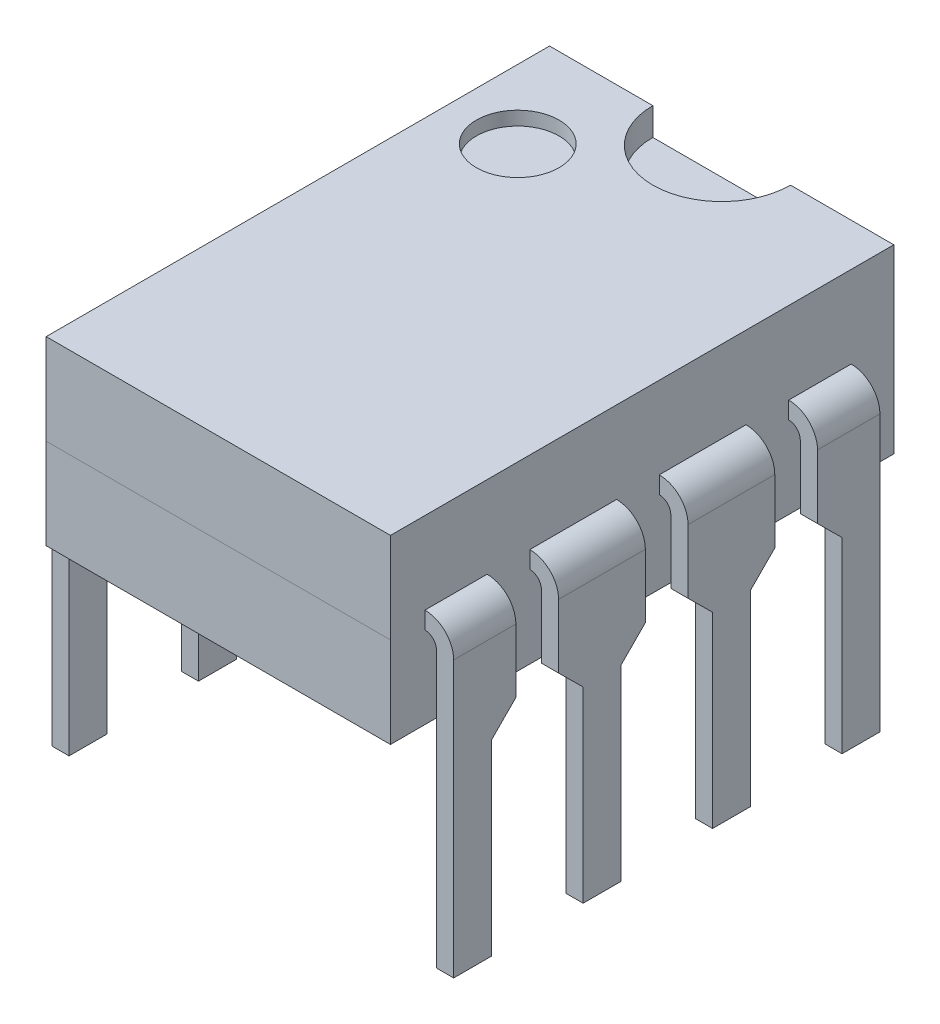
SolidWorks part; units mm, degrees
ref_plane "Front Plane" through (0, 0, 0) normal (0, 0, 1) x (1, 0, 0)
ref_plane "Top Plane" through (0, 0, 0) normal (0, 1, 0) x (1, 0, 0)
ref_plane "Right Plane" through (0, 0, 0) normal (1, 0, 0) x (0, 0, -1)
sketch "Sketch1" plane through (0, 0, 0) normal (0, 1, 0) x (1, 0, 0)
  line L1 (-3.175, 4.6419) -> (3.175, 4.6419)
  line L2 (-3.175, 4.6419) -> (-3.175, -4.6418)
  line L3 (-3.175, -4.6418) -> (3.175, -4.6418)
  line L4 (3.175, 4.6419) -> (3.175, -4.6418)
  dimension "D1" = 6.35
  dimension "D2" = 9.2837
  dimension "D3" = 3.175
  dimension "D4" = 4.6418
extrude "Boss-Extrude1" add sketch "Sketch1" along normal mid plane 3.3401
sketch "Sketch2" plane through (0, 0, 0) normal (0, 1, 0) x (1, 0, 0)
  line L0 (3.175, -2.8595) -> (4.932, -2.8595)
  line L1 (3.175, -4.6418) -> (3.175, 4.6419) construction
  line L2 (4.932, -2.8595) -> (5.3848, -3.3084)
  line L3 (5.3848, -3.3084) -> (8.8392, -3.3084)
  line L4 (8.8392, -3.3084) -> (8.8392, -4.0069)
  line L5 (8.8392, -4.0069) -> (5.3848, -4.0069)
  line L6 (3.175, -4.0069) -> (3.175, -2.8595)
  line L7 (3.175, -2.0721) -> (3.175, -0.4719)
  line L8 (3.175, -0.4719) -> (4.932, -0.4719)
  line L9 (4.932, -0.4719) -> (5.3848, -0.9208)
  line L10 (5.3848, -0.9208) -> (8.8392, -0.9208)
  line L11 (8.8392, -0.9208) -> (8.8392, -1.6193)
  line L12 (8.8392, -1.6193) -> (5.3848, -1.6193)
  line L13 (5.3848, -1.6193) -> (4.9359, -2.0721)
  line L14 (4.9359, -2.0721) -> (3.175, -2.0721)
  line L15 (3.175, 1.9157) -> (4.932, 1.9157)
  line L16 (4.932, 1.9157) -> (5.3848, 1.4668)
  line L17 (5.3848, 1.4668) -> (8.8392, 1.4668)
  line L18 (8.8392, 1.4668) -> (8.8392, 0.7684)
  line L19 (8.8392, 0.7684) -> (5.3848, 0.7684)
  line L20 (5.3848, 0.7684) -> (4.9359, 0.3155)
  line L21 (4.9359, 0.3155) -> (3.175, 0.3155)
  line L22 (3.175, 0.3155) -> (3.175, 1.9157)
  line L23 (3.175, 2.7031) -> (3.175, 3.8544)
  line L24 (5.3848, 3.8544) -> (8.8392, 3.8544)
  line L25 (8.8392, 3.8544) -> (8.8392, 3.156)
  line L26 (8.8392, 3.156) -> (5.3848, 3.156)
  line L27 (5.3848, 3.156) -> (4.9359, 2.7031)
  line L28 (4.9359, 2.7031) -> (3.175, 2.7031)
  line L29 (5.3848, 3.8544) -> (3.175, 3.8544)
  line L30 (5.3848, -4.0069) -> (3.175, -4.0069)
  line L32 (4.9359, -4.4597) -> (3.175, -4.4597)
  line L33 (5.3848, -4.0069) -> (4.9359, -4.4597)
  line L34 (3.175, 4.3033) -> (4.932, 4.3033)
  line L35 (4.932, 4.3033) -> (5.3848, 3.8544)
  dimension "D1" = 4.932
  dimension "D2" = 0.6985
  dimension "D3" = 5.6642
  dimension "D4" = 3.4544
  dimension "D5" = 0.4489
  dimension "D6" = 4.0069
  dimension "D8" = 4.9359
  dimension "D9" = 0.3155
  dimension "D7" = 4
extrude "Boss-Extrude2" add sketch "Sketch2" along normal mid plane 0.3175
sketch "Sketch4" plane through (0, 0, 0) normal (0, 0, 1) x (1, 0, 0)
  line L0 (-3.175, 0) -> (3.175, 0)
  line L1 (-3.175, 1.6701) -> (-3.175, -1.6701) construction
  line L2 (3.175, 1.6701) -> (3.175, -1.6701) construction
sketch "Sketch6" plane through (0, 0, 0) normal (1, 0, 0) x (0, 0, -1)
  line L0 (-4.6418, 0) -> (4.6419, 0)
mirror "Mirror1" about plane through (0, 0, 0) normal (1, 0, 0) of "Boss-Extrude2"
sketch "Sketch7" plane through (0, 1.6701, 0) normal (0, 1, 0) x (1, 0, 0)
  line L1 (-3.175, 4.6419) -> (-3.175, -4.6418) construction
  line L2 (3.175, 4.6419) -> (-3.175, 4.6419) construction
  circle A0 centre (-1.905, 2.7851) radius 0.762
  dimension "D3" = 1.524
  dimension "D1" = 1.8567
  dimension "D2" = 1.27
extrude "Cut-Extrude1" cut sketch "Sketch7" against normal blind 0.254
sketch "Sketch8" plane through (0, 1.6701, 0) normal (0, 1, 0) x (1, 0, 0)
  line L0 (3.175, 4.6419) -> (-3.175, 4.6419) construction
  line L1 (-1.27, 4.6419) -> (1.27, 4.6419)
  arc A0 (-1.27, 4.6419) -> (1.27, 4.6419) centre (0, 4.6419) ccw
  dimension "D1" = 2.54
extrude "Cut-Extrude2" cut sketch "Sketch8" against normal blind 0.508
split "Split1" bodies to split 107 resulting bodies 110 111 112 113 114
other "Flex1" parameters "D0"=90, "D1"=5.08, "D2"=0
split "Split2" bodies to split 114 resulting bodies 119 120 121 122 123
other "Flex2" parameters "D0"=90, "D1"=5.08, "D2"=0
equation "\"D3@Sketch1\"=\"D1@Sketch1\"/2"
equation "\"D4@Sketch1\"=\"D2@Sketch1\"/2"
equation "\"D6@Sketch2\"=\"D2@Sketch1\"/2-(.025)"
equation "\"D2@Sketch7\"=\"D1@Sketch1\"/5"
equation "\"D1@Sketch7\"=\"D2@Sketch1\"/5"
